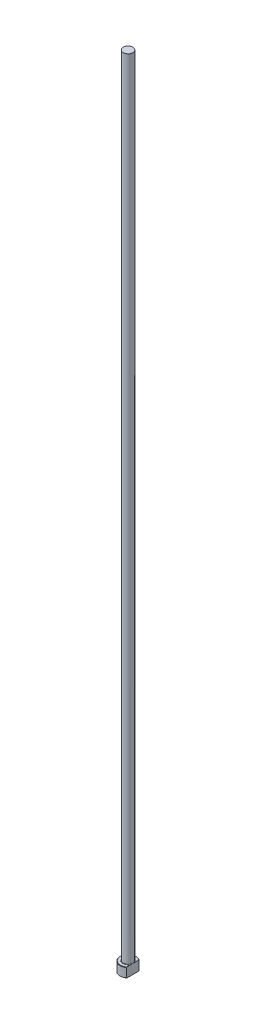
SolidWorks part; units mm, degrees
ref_plane "Front Plane" through (0, 0, 0) normal (0, 0, 1) x (1, 0, 0)
ref_plane "Top Plane" through (0, 0, 0) normal (0, 1, 0) x (1, 0, 0)
ref_plane "Right Plane" through (0, 0, 0) normal (1, 0, 0) x (0, 0, -1)
sketch "Sketch1" plane through (0, 0, 0) normal (0, 0, 1) x (1, 0, 0)
  line L0 (0, 259.9588) -> (0, -15.1925) construction
  line L1 (0, 0) -> (-5, 0)
  line L2 (-5, 0) -> (-5, 6)
  line L3 (-5, 6) -> (-3, 6)
  line L4 (-3, 6) -> (-3, 500)
  line L5 (-3, 500) -> (0, 500)
  line L6 (0, 500) -> (0, 0)
  dimension "L" = 500
  dimension "H" = 10
  dimension "T" = 6
  dimension "D" = 6
revolve "Revolve1" add sketch "Sketch1" angle 360 about L0
chamfer "Chamfer1" distance 0.2 angle 45 2 edges at (0, 6, 5) (0, 0, 5)
fillet "Fillet1" radius 0.2 1 edges at (0, 6, 3)
sketch "Sketch2" plane through (0, 0, 0) normal (0, 1, 0) x (1, 0, 0)
  line L0 (3, -4) -> (3, 4)
  circle A0 centre (0, 0) radius 5 construction
  arc A1 (3, -4) -> (3, 4) centre (0, 0) ccw
  circle A2 centre (0, 0) radius 3 construction
extrude "KEYED HEAD" cut sketch "Sketch2" along normal through all
